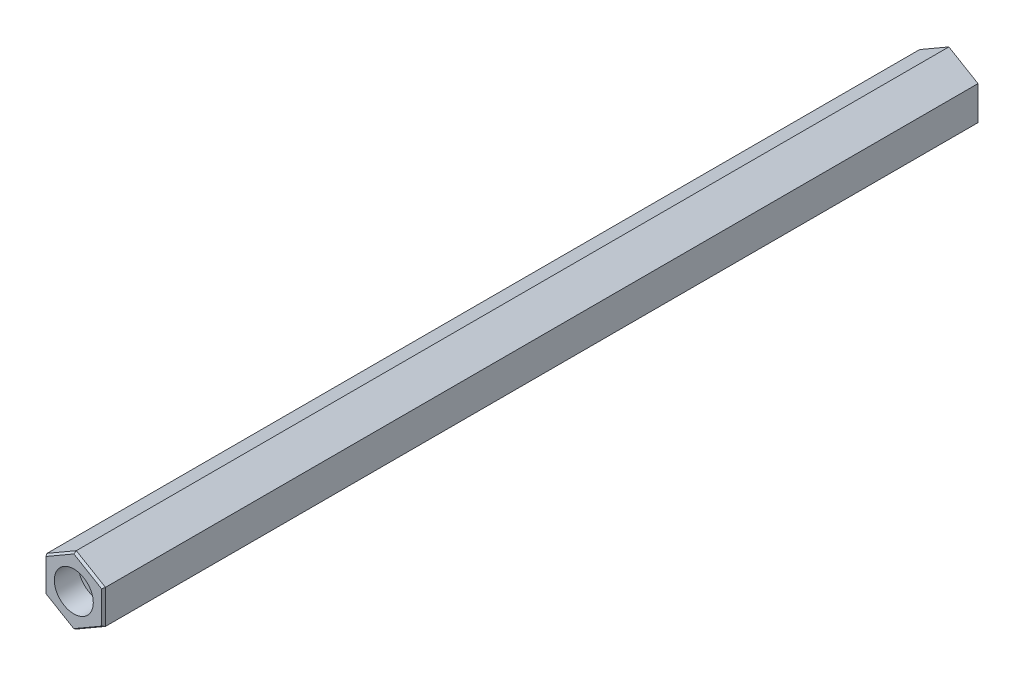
SolidWorks part; units mm, degrees
ref_plane "Face" through (0, 0, 0) normal (0, 0, 1) x (1, 0, 0)
ref_plane "Dessus" through (0, 0, 0) normal (0, 1, 0) x (1, 0, 0)
ref_plane "Droite" through (0, 0, 0) normal (1, 0, 0) x (0, 0, -1)
sketch "Esquisse1" plane through (0, 0, 0) normal (0, 0, 1) x (1, 0, 0)
  line L0 (0, 90.4939) -> (0, -104.8221) construction
  line L1 (115.1912, 0) -> (-116.3224, 0) construction
  line L2 (12, 6.95) -> (12, -6.95)
  line L4 (-12, -6.8529) -> (-0.0284, -13.9162)
  line L5 (-12, 7.0471) -> (0.0284, 14.0133)
  line L6 (0.0284, 14.0133) -> (12, 6.95)
  line L7 (-12, 7.0471) -> (-12, -6.8529)
  line L8 (12, -6.95) -> (-0.0284, -13.9162)
  dimension "D1" = 13.9
  dimension "D2" = 6.95
  dimension "D3" = 6.95
  dimension "D4" = 13.9
  dimension "D5" = 13.9
  dimension "D6" = 13.9
  dimension "D7" = 13.9
extrude "Base-Extrusion" add sketch "Esquisse1" against normal mid plane 360
sketch "Esquisse3" plane through (0, 0, -180) normal (0, 0, -1) x (-1, 0, 0)
  line L0 (0, 16.8485) -> (0, -20.3703) construction
  line L1 (18.8131, 0) -> (-21.0276, 0) construction
chamfer "Chanfrein1" distance 1 angle 30 12 edges at (5.9858, -10.4331, -180) (12, 0, -180) (6.0142, 10.4817, -180) (-5.9858, 10.5302, -180) (-12, 0.0971, -180) (-5.9858, 10.5302, 180) (6.0142, 10.4817, 180) (12, 0, 180) (5.9858, -10.4331, 180) (-6.0142, -10.3846, -180) (-6.0142, -10.3846, 180) (-12, 0.0971, 180)
sketch "Esquisse4" plane through (0, 0, -180) normal (0, 0, -1) x (-1, 0, 0)
  circle A0 centre (0, 0) radius 8
  dimension "D1" = 16
extrude "Enlèv. mat.-Extru.1" cut sketch "Esquisse4" against normal blind 10
sketch "Esquisse5" plane through (0, 0, 180) normal (0, 0, 1) x (1, 0, 0)
  circle A0 centre (0, 0) radius 8
  dimension "D1" = 16
extrude "Enlèv. mat.-Extru.2" cut sketch "Esquisse5" against normal blind 10
